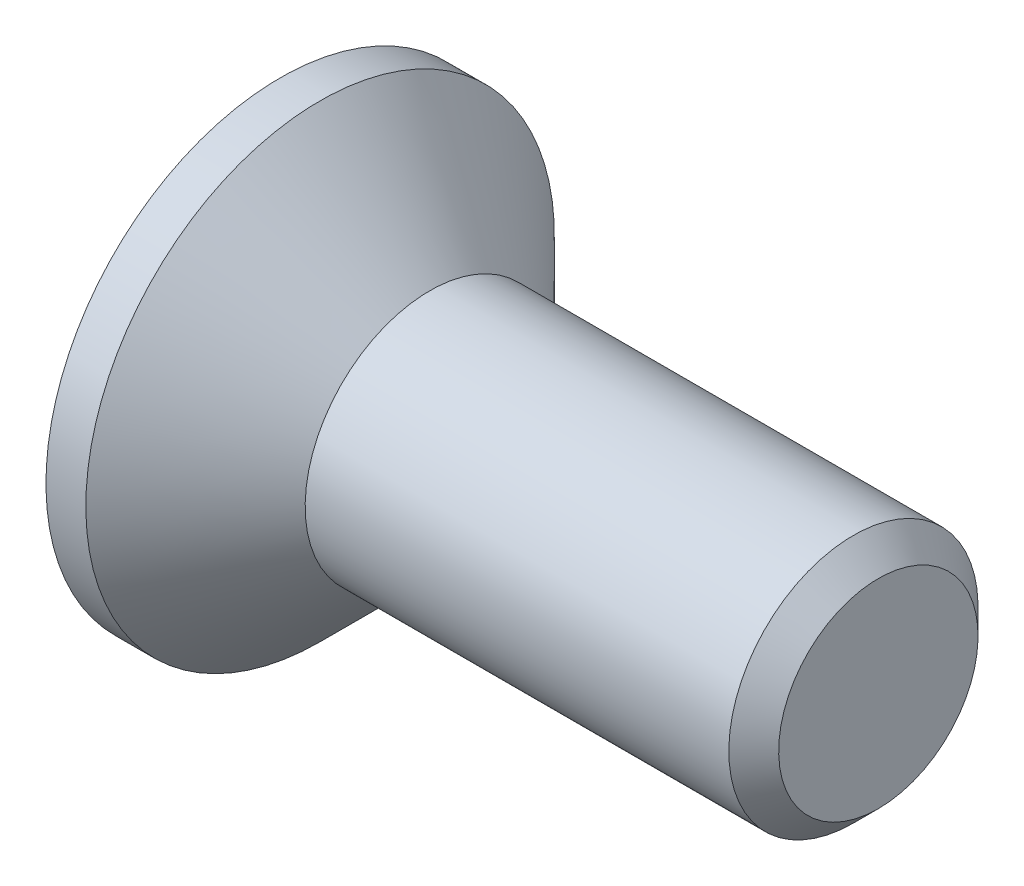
SolidWorks part; units mm, degrees
ref_plane "Front Plane" through (0, 0, 0) normal (0, 0, 1) x (1, 0, 0)
ref_plane "Top Plane" through (0, 0, 0) normal (0, 1, 0) x (1, 0, 0)
ref_plane "Right Plane" through (0, 0, 0) normal (1, 0, 0) x (0, 0, -1)
sketch "Sketch1" plane through (0, 0, 0) normal (0, 0, 1) x (1, 0, 0)
  line L1 (-1.5, 2.35) -> (-1.5, 0)
  line L2 (-1.5, 0) -> (4.5, 0)
  line L3 (4.5, 0) -> (4.5, 1.25)
  line L4 (4.5, 1.25) -> (0, 1.25)
  line L5 (-1.5, 2.35) -> (-1.1, 2.35)
  line L6 (-1.1, 2.35) -> (0, 1.25)
  dimension "D1" = 1.25
  dimension "D2" = 45
  dimension "D3" = 1.5
  dimension "D4" = 6
  dimension "D5" = 2.35
revolve "Revolve1" add sketch "Sketch1" angle 360 about L2
chamfer "Chamfer1" distance 0.25 angle 45 1 edges at (4.5, -1.25, 0)
sketch "Sketch2" plane through (-1.5, 0, 0) normal (-1, 0, 0) x (0, 0, 1)
  line L0 (-0.34, 1.35) -> (0.34, 1.35)
  line L1 (0.34, 1.35) -> (0.34, 0.34)
  line L2 (0.34, 0.34) -> (1.35, 0.34)
  line L3 (1.35, 0.34) -> (1.35, -0.34)
  line L4 (1.35, -0.34) -> (0.34, -0.34)
  line L5 (0.34, -0.34) -> (0.34, -1.35)
  line L6 (0.34, -1.35) -> (-0.34, -1.35)
  line L7 (-0.34, -1.35) -> (-0.34, -0.34)
  line L8 (-0.34, -0.34) -> (-1.35, -0.34)
  line L9 (-1.35, -0.34) -> (-1.35, 0.34)
  line L10 (-1.35, 0.34) -> (-0.34, 0.34)
  line L11 (-0.34, 0.34) -> (-0.34, 1.35)
  point P2 (0, 1.35)
  point P14 (0, -1.35)
  point P15 (1.35, 0)
  point P16 (-1.35, 0)
  dimension "D1" = 2.7
  dimension "D2" = 0.68
extrude "Cut-Extrude1" cut sketch "Sketch2" against normal blind 1.25
